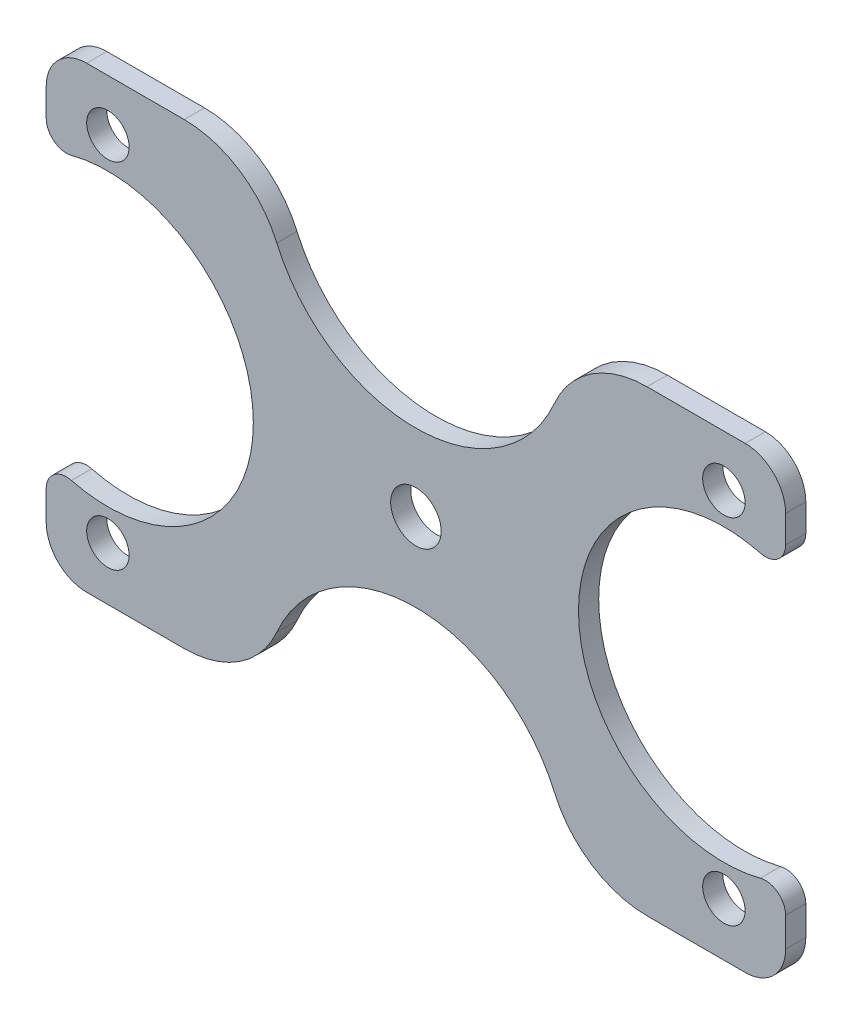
SolidWorks part; units mm, degrees
ref_plane "Plan de face" through (0, 0, 0) normal (0, 0, 1) x (1, 0, 0)
ref_plane "Plan de dessus" through (0, 0, 0) normal (0, 1, 0) x (1, 0, 0)
ref_plane "Plan de droite" through (0, 0, 0) normal (1, 0, 0) x (0, 0, -1)
sketch "Esquisse1" plane through (0, 0, 0) normal (0, 0, 1) x (1, 0, 0)
  line L0 (-30.5, 17.5) -> (-30.5, -17.5) construction
  line L1 (-30.5, 0) -> (30.5, 0) construction
  line L2 (30.5, 17.5) -> (30.5, -17.5) construction
  line L3 (-36.6102, 15.8766) -> (-36.6102, 18.5968)
  line L4 (-32.6102, 22.5968) -> (-22.9379, 22.5968)
  line L5 (-36.6102, 22.5968) -> (-36.6982, 22.4857)
  line L6 (22.8878, 22.5968) -> (32.6102, 22.5968)
  line L7 (36.6102, -15.8766) -> (36.6102, -18.7778)
  line L8 (-36.6102, -15.8766) -> (-36.6102, -18.7778)
  line L9 (36.6102, 15.8766) -> (36.6102, 18.5968)
  line L10 (32.6102, -22.7778) -> (22.8878, -22.7778)
  line L11 (-22.9379, -22.7778) -> (-32.6102, -22.7778)
  line L12 (-36.6102, -22.7778) -> (-36.4714, -22.4318)
  arc A0 (34.1089, 13.9404) -> (34.1089, -13.9404) centre (30.5, 0) ccw
  circle A1 centre (0, 0) radius 2.5
  circle A2 centre (-30.5, 17.5) radius 2.1
  circle A3 centre (-30.5, -17.5) radius 2.1
  circle A4 centre (30.5, -17.5) radius 2.1
  circle A5 centre (30.5, 17.5) radius 2.1
  arc A6 (-34.1089, 13.9404) -> (-34.1089, -13.9404) centre (-30.5, 0) cw
  arc A7 (-13.7728, 16.5968) -> (13.7227, 16.5968) centre (-0.0251, 22.5968) ccw
  arc A8 (-13.7728, -16.7778) -> (13.7227, -16.7778) centre (-0.0251, -22.7778) cw
  arc A9 (-22.9379, 22.5968) -> (-13.7728, 16.5968) centre (-22.9379, 12.5968) cw
  arc A10 (22.8878, 22.5968) -> (13.7227, 16.5968) centre (22.8878, 12.5968) ccw
  arc A11 (22.8878, -22.7778) -> (13.7227, -16.7778) centre (22.8878, -12.7778) cw
  arc A12 (-22.9379, -22.7778) -> (-13.7728, -16.7778) centre (-22.9379, -12.7778) ccw
  arc A13 (-36.6102, 18.5968) -> (-32.6102, 22.5968) centre (-32.6102, 18.5968) cw
  arc A14 (-32.6102, -22.7778) -> (-36.6102, -18.7778) centre (-32.6102, -18.7778) cw
  arc A15 (36.6102, -18.7778) -> (32.6102, -22.7778) centre (32.6102, -18.7778) cw
  arc A16 (36.6102, 15.8766) -> (34.1089, 13.9404) centre (34.6102, 15.8766) cw
  arc A17 (34.1089, -13.9404) -> (36.6102, -15.8766) centre (34.6102, -15.8766) cw
  arc A18 (-34.1089, -13.9404) -> (-36.6102, -15.8766) centre (-34.6102, -15.8766) ccw
  arc A19 (-36.6102, 15.8766) -> (-34.1089, 13.9404) centre (-34.6102, 15.8766) ccw
  arc A20 (32.6102, 22.5968) -> (36.6102, 18.5968) centre (32.6102, 18.5968) cw
  point P12 (0, 0)
  point P13 (-30.5, 0)
  point P14 (30.5, 0)
  dimension "D1" = 14.4
  dimension "D2" = 30.5
  dimension "D5" = 4.2
  dimension "D6" = 15
  dimension "D4" = 5
  dimension "D8" = 15
  dimension "D7" = 10
  dimension "D9" = 10
  dimension "D10" = 10
  dimension "D11" = 10
  dimension "D12" = 4
  dimension "D13" = 4
  dimension "D14" = 4
  dimension "D15" = 2
  dimension "D16" = 2
  dimension "D17" = 2
  dimension "D18" = 2
  dimension "D19" = 4
  dimension "D3" = 17.5
extrude "Boss.-Extru.1" add sketch "Esquisse1" along normal blind 2
